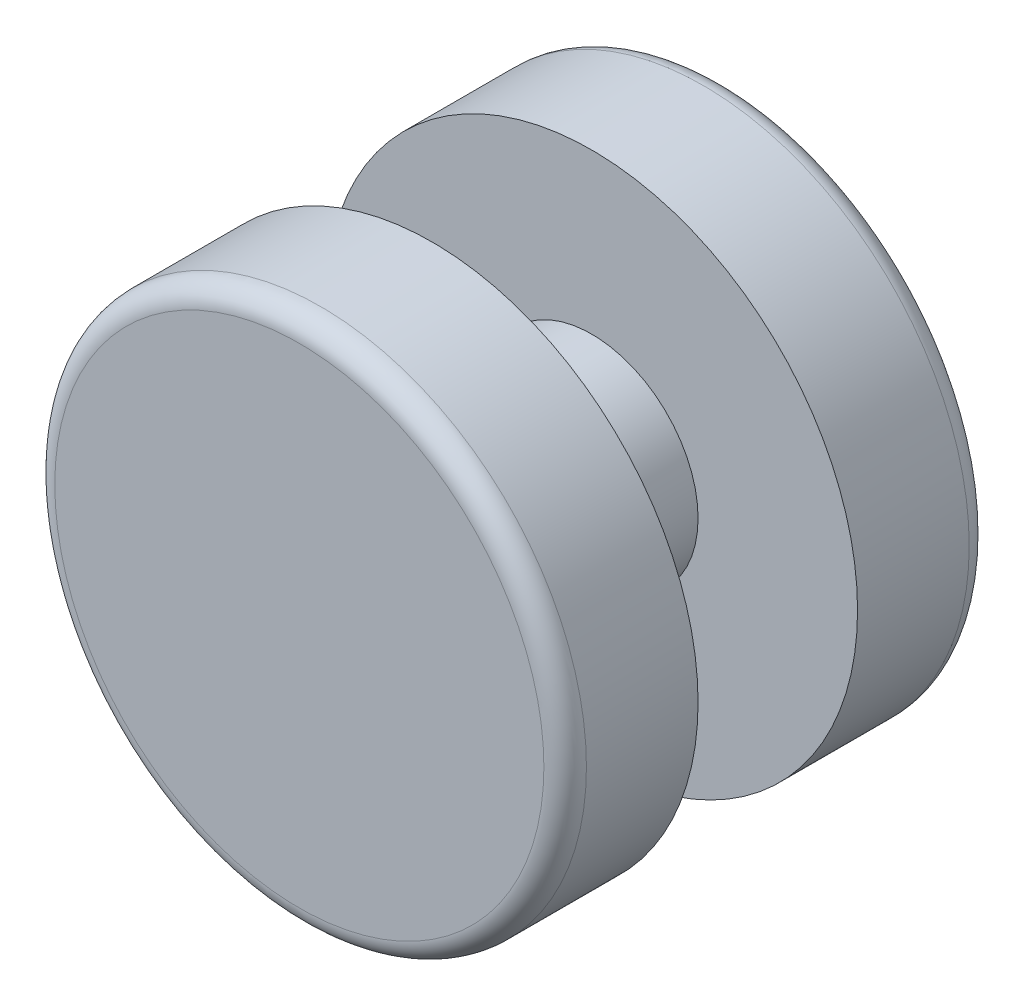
SolidWorks part; units mm, degrees
ref_plane "Plan1" through (0, 0, 0) normal (0, 0, 1) x (1, 0, 0)
ref_plane "Plan2" through (0, 0, 0) normal (0, 1, 0) x (1, 0, 0)
ref_plane "Plan3" through (0, 0, 0) normal (1, 0, 0) x (0, 0, -1)
sketch "Esquisse1" plane through (0, 0, 0) normal (0, 0, 1) x (1, 0, 0)
  circle A0 centre (0, 0) radius 2.5
  dimension "D1" = 5
extrude "Base-Extrusion" add sketch "Esquisse1" along normal mid plane 4
sketch "Esquisse2" plane through (0, 0, 0) normal (0, 0, 1) x (1, 0, 0)
  circle A0 centre (0, 0) radius 1
  circle A1 centre (0, 0) radius 5
  dimension "D1" = 10
  dimension "D2" = 2
extrude "Enlèv. mat.-Extru.1" cut sketch "Esquisse2" against normal mid plane 1.5
fillet "Congé1" radius 0.2
